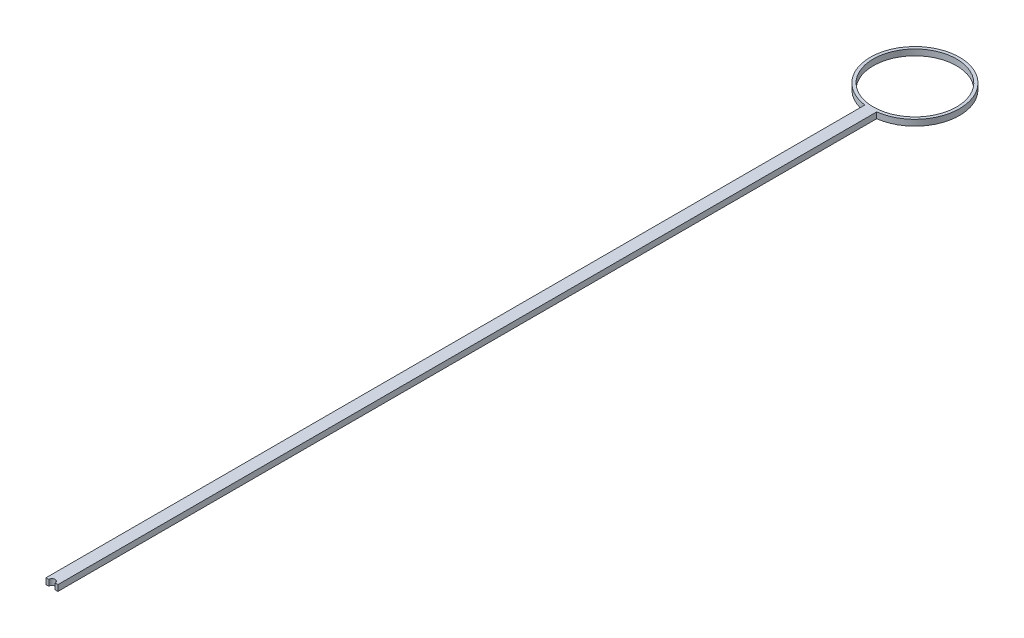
SolidWorks part; units mm, degrees
ref_plane "Vorderseite" through (0, 0, 0) normal (0, 0, 1) x (1, 0, 0)
ref_plane "Oben" through (0, 0, 0) normal (0, 1, 0) x (1, 0, 0)
ref_plane "Rechts" through (0, 0, 0) normal (1, 0, 0) x (0, 0, -1)
sketch "Skizze1" plane through (0, 0, 0) normal (0, 1, 0) x (1, 0, 0)
  line L1 (-530, -120) -> (-452, -120)
  line L3 (0, 0) -> (0, 2902.3)
  line L4 (0, 0) -> (0, -120)
  line L5 (0, -120) -> (0, -32.5)
  line L6 (0, -32.5) -> (-126, -32.5)
  line L7 (-530, 0) -> (530, 0) construction
  line L8 (530, 150) -> (530, -150)
  line L9 (-530, 150) -> (-530, -150)
  line L10 (530, -120) -> (452, -120)
  line L11 (-452, -120) -> (0, -120)
  line L12 (0, -120) -> (452, -120)
  line L13 (-530, -1040) -> (530, -1040) construction
  line L14 (0, 0) -> (0, -1040) construction
  line L15 (529.9542, -890) -> (530.0458, -1190)
  line L16 (-530.0526, -867.5292) -> (-529.9474, -1212.4708)
  line L17 (-530.0366, -920) -> (-452.0366, -919.9762)
  line L18 (529.9634, -920) -> (451.9634, -920.0238)
  line L19 (-0.0366, -920) -> (0, -1040)
  line L20 (-0.0099, -1007.5) -> (125.9901, -1007.4615)
  line L21 (-126, -32.5) -> (125.9901, -1007.4615)
  line L22 (-452.0366, -919.9762) -> (-0.0366, -920)
  line L23 (-0.0366, -920) -> (451.9634, -920.0238)
  line L24 (0, -1356) -> (0, -1040)
  line L25 (344.7172, -520) -> (0, -520)
  circle A0 centre (0, 0) radius 7.3181
  point P13 (0, 0)
  point P17 (-530, 0)
  point P19 (530, 0)
  point P30 (-530, -1040)
  point P31 (530, -1040)
  dimension "D3" = 2902.3
  dimension "D5" = 32.5
  dimension "D6" = 120
  dimension "D7" = 1060
  dimension "D8" = 78
  dimension "D9" = 120
  dimension "D10" = 120
  dimension "D11" = 452
  dimension "D14" = 300
  dimension "D15" = 1040
  dimension "D16" = 126
  dimension "D17" = 120
  dimension "D18" = 120
  dimension "D19" = 32.5
  dimension "D20" = 1007
  dimension "D21" = 316
sketch "Skizze2" plane through (0, 0, 0) normal (0, 1, 0) x (1, 0, 0)
  line L0 (-530, 0) -> (530, 0) construction
  line L2 (-20, 2753.6393) -> (-20, 0)
  line L3 (-20, 0) -> (-10.7049, 0)
  line L4 (20, 2753.6393) -> (20, 0)
  line L5 (10.7049, 0) -> (20, 0)
  line L6 (0, 0) -> (0, 2902.3) construction
  circle A0 centre (0, 2902.3) radius 140
  arc A1 (20, 2753.6393) -> (-20, 2753.6393) centre (0, 2902.3) ccw
  arc A2 (10.7049, 0) -> (-10.7049, 0) centre (0, 0) ccw
  dimension "D2" = 280
  dimension "D3" = 300
  dimension "D5" = 10.7049
  dimension "D1" = 40
  dimension "D4" = 0
extrude "Aufsatz-Linear austragen1" add sketch "Skizze2" along normal blind 20
